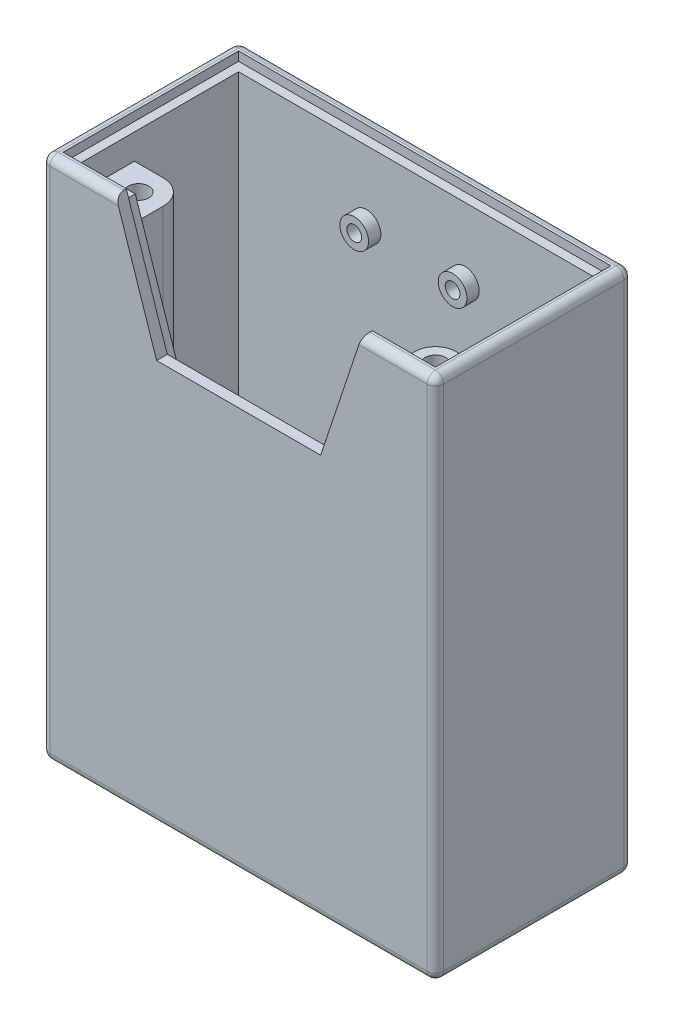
SolidWorks part; units mm, degrees
ref_plane "Ebene vorne" through (0, 0, 0) normal (0, 0, 1) x (1, 0, 0)
ref_plane "Ebene oben" through (0, 0, 0) normal (0, 1, 0) x (1, 0, 0)
ref_plane "Ebene rechts" through (0, 0, 0) normal (1, 0, 0) x (0, 0, -1)
sketch "Skizze1" plane through (0, 0, 0) normal (0, 1, 0) x (1, 0, 0)
  line L1 (24, 12) -> (-24, 12)
  line L2 (24, 12) -> (24, -12)
  line L3 (24, -12) -> (-24, -12)
  line L4 (-24, 12) -> (-24, -12)
  line L5 (24, 12) -> (-24, -12) construction
  line L6 (24, -12) -> (-24, 12) construction
  point P0 (0, 0)
  dimension "D1" = 24
  dimension "D2" = 48
extrude "Aufsatz-Linear austragen1" add sketch "Skizze1" along normal blind 8
sketch "Skizze2" plane through (0, 8, 0) normal (0, 1, 0) x (1, 0, 0)
  line L0 (-21.6, 9.6) -> (-21.6, -9.6)
  line L1 (-24, 12) -> (24, 12)
  line L2 (-24, 12) -> (-24, -12)
  line L3 (-24, -12) -> (24, -12)
  line L4 (24, 12) -> (24, -12)
  line L5 (-21.6, -9.6) -> (21.6, -9.6)
  line L6 (21.6, 9.6) -> (21.6, -9.6)
  line L7 (-21.6, 9.6) -> (21.6, 9.6)
  dimension "D1" = 2.4
extrude "Aufsatz-Linear austragen2" add sketch "Skizze2" along normal blind 56
sketch "Skizze6" plane through (0, 0, 12) normal (0, 0, 1) x (1, 0, 0)
  line L0 (0, 0) -> (0, 64) construction
  line L1 (-24, 0) -> (24, 0) construction
  line L2 (-24, 64) -> (24, 64) construction
  line L3 (15, 64) -> (-15, 64)
  line L4 (-15, 64) -> (-10, 49)
  line L5 (-10, 49) -> (10, 49)
  line L7 (15, 64) -> (10, 49)
  point P10 (0, 49)
  dimension "D1" = 10
  dimension "D2" = 15
  dimension "D3" = 15
extrude "Schnitt-Linear austragen3" cut sketch "Skizze6" against normal up to surface (2.4 mm away)
sketch "Skizze3" plane through (0, 0, 0) normal (0, -1, 0) x (1, 0, 0)
  line L0 (-24, 0) -> (0, 0) construction
  line L1 (-24, -12) -> (-24, 12) construction
  circle A0 centre (-4, 0) radius 4
  dimension "D1" = 8
  dimension "D2" = 20
extrude "Loch Achse" cut sketch "Skizze3" against normal up to surface (8 mm away)
sketch "Skizze4" plane through (0, 8, 0) normal (0, 1, 0) x (1, 0, 0)
  line L0 (-24, 0) -> (24, 0) construction
  line L1 (-24, 12) -> (-24, -12) construction
  line L2 (24, -12) -> (24, 12) construction
  line L3 (-21.6, -9.6) -> (-15, -9.6) construction
  line L4 (-21.6, 9.6) -> (-10.4, 9.6)
  line L5 (-21.6, 9.6) -> (-21.6, -9.6)
  line L6 (-21.6, -9.6) -> (-10.4, -9.6)
  line L7 (-10.4, 9.6) -> (-10.4, -9.6)
  line L8 (-21.6, -9.6) -> (21.6, -9.6) construction
  line L9 (21.6, 9.6) -> (12.9, 9.6)
  line L10 (21.6, 9.6) -> (21.6, -9.6)
  line L11 (21.6, -9.6) -> (12.9, -9.6)
  line L12 (12.9, 9.6) -> (12.9, -9.6)
  circle A0 centre (-12.4, 0) radius 0.8 construction
  circle A1 centre (15.2, 0) radius 0.8 construction
  dimension "D1" = 1.6
  dimension "D2" = 1.6
  dimension "D3" = 11.6
  dimension "D4" = 8.8
  dimension "D5" = 13.6
  dimension "D6" = 11.1
extrude "Aufsatz-Linear austragen3" add sketch "Skizze4" along normal blind 11.6
sketch "Skizze5" plane through (0, 19.6, 0) normal (0, 1, 0) x (1, 0, 0)
  line L0 (-24, 0) -> (24, 0) construction
  line L1 (-24, 12) -> (-24, -12) construction
  line L2 (24, -12) -> (24, 12) construction
  circle A0 centre (-12.4, 0) radius 0.8
  circle A1 centre (15.2, 0) radius 0.8
  dimension "D1" = 1.6
  dimension "D2" = 1.6
  dimension "D3" = 11.6
  dimension "D4" = 8.8
extrude "Schnitt-Linear austragen2" cut sketch "Skizze5" against normal blind 8
sketch "Skizze7" plane through (0, 64, 0) normal (0, 1, 0) x (1, 0, 0)
  line L0 (-15, -9.6) -> (-21.6, -9.6)
  line L1 (-21.6, -9.6) -> (-21.6, 9.6)
  line L2 (-21.6, 9.6) -> (21.6, 9.6)
  line L3 (21.6, 9.6) -> (21.6, -9.6)
  line L4 (21.6, -9.6) -> (15, -9.6)
  line L5 (-15, -10.7) -> (-22.7, -10.7)
  line L6 (-22.7, -10.7) -> (-22.7, 10.7)
  line L7 (-22.7, 10.7) -> (22.7, 10.7)
  line L8 (22.7, 10.7) -> (22.7, -10.7)
  line L9 (22.7, -10.7) -> (15, -10.7)
  line L10 (-15, -10.7) -> (-15, -9.6)
  line L11 (15, -9.6) -> (15, -10.7)
  dimension "D1" = 1.1
extrude "Schnitt-Linear austragen4" cut sketch "Skizze7" against normal blind 1.1 contours L6 L7 L8 L9 L11 L4 L3 L2 L1 L0 L10 L5
sketch "Skizze8" plane through (0, 0, 9.6) normal (0, 0, -1) x (-1, 0, 0)
  line L0 (-15, 64) -> (-10, 49)
  line L1 (-10, 49) -> (10, 49)
  line L2 (10, 49) -> (15, 64)
  line L3 (15, 64) -> (15, 62.9)
  line L4 (15, 62.9) -> (10, 47.9)
  line L5 (10, 47.9) -> (-10, 47.9)
  line L6 (-10, 47.9) -> (-15, 62.9)
  line L7 (-15, 64) -> (-15, 62.9)
  dimension "D1" = 1.1
extrude "Schnitt-Linear austragen5" cut sketch "Skizze8" against normal blind 1.1
sketch "Skizze9" plane through (0, 0, -9.6) normal (0, 0, 1) x (1, 0, 0)
  line L0 (0, 0) -> (0, 64) construction
  line L1 (-22.7, 64) -> (22.7, 64) construction
  circle A0 centre (-6, 54.4) radius 1.75
  circle A1 centre (6, 54.4) radius 1.75
  dimension "D1" = 6
  dimension "D2" = 3.5
  dimension "D3" = 9.6
extrude "Aufsatz-Linear austragen4" add sketch "Skizze9" along normal blind 1.5
sketch "Skizze10" plane through (0, 0, -8.1) normal (0, 0, 1) x (1, 0, 0)
  circle A0 centre (-6, 54.4) radius 0.9
  circle A1 centre (6, 54.4) radius 0.9
  dimension "D1" = 1.8
  dimension "D2" = 1.8
extrude "Schnitt-Linear austragen6" cut sketch "Skizze10" against normal blind 3
ref_plane "Ebene1" through (0, 59.8, 0) normal (0, 1, 0) x (1, 0, 0)
sketch "Skizze12" plane through (0, 59.8, 0) normal (0, 1, 0) x (1, 0, 0)
  line L0 (-18.1, -3.6) -> (-21.6, -3.6)
  line L1 (-21.6, -9.6) -> (-21.6, 9.6) construction
  line L2 (-21.6, -3.6) -> (-21.6, -9.6)
  line L3 (-21.6, -9.6) -> (-15.6, -9.6)
  line L4 (-15, -9.6) -> (-21.6, -9.6) construction
  line L5 (-15.6, -9.6) -> (-15.6, -6.1)
  line L6 (21.6, 9.6) -> (21.6, -9.6) construction
  line L7 (21.6, -9.6) -> (15, -9.6) construction
  line L8 (15.6, -6.1) -> (15.6, -9.6)
  line L9 (15.6, -9.6) -> (21.6, -9.6)
  line L10 (21.6, -9.6) -> (21.6, -3.6)
  line L11 (21.6, -3.6) -> (18.1, -3.6)
  circle A0 centre (-18.1, -6.1) radius 1.25
  circle A1 centre (18.1, -6.1) radius 1.25
  arc A3 (18.1, -3.6) -> (15.6, -6.1) centre (18.1, -6.1) ccw
  arc A4 (-15.6, -6.1) -> (-18.1, -3.6) centre (-18.1, -6.1) ccw
  dimension "D1" = 2.5
  dimension "D2" = 2.5
  dimension "D3" = 3.5
  dimension "D4" = 3.5
  dimension "D5" = 2.5
  dimension "D6" = 5
  dimension "D7" = 3.5
  dimension "D8" = 3.5
extrude "Montage_Deckel" add sketch "Skizze12" against normal blind 7
sketch "Skizze11" plane through (0, 19.6, 0) normal (0, 1, 0) x (1, 0, 0)
  line L0 (-21.6, -9.6) -> (-21.6, 9.6) construction
  line L1 (-15, -9.6) -> (-21.6, -9.6) construction
  line L2 (-18.1, -3.1) -> (-21.6, -3.1)
  line L3 (-15.1, -6.1) -> (-15.1, -9.6)
  line L4 (-10, -9.6) -> (-15, -9.6) construction
  line L5 (-15.1, -9.6) -> (-21.6, -9.6)
  line L6 (-21.6, -9.6) -> (-21.6, -3.1)
  circle A0 centre (-18.1, -6.1) radius 1.3
  arc A1 (-15.1, -6.1) -> (-18.1, -3.1) centre (-18.1, -6.1) ccw
  dimension "D1" = 3.5
  dimension "D3" = 2.6
  dimension "D4" = 3
  dimension "D2" = 3.5
extrude "Aufsatz-Linear austragen5" add sketch "Skizze11" along normal blind 40.2
sketch "Skizze14" plane through (0, 0, 0) normal (0, 0, 1) x (1, 0, 0)
  line L0 (0, 0) -> (-8, 0) construction
  line L1 (-4, 0) -> (-4, 6.3366) construction
  line L2 (-12, 11.0059) -> (-12, 0) construction
  line L3 (-8, 0) -> (-18.9294, 0) construction
  line L4 (-12, 0) -> (-8.95, 0)
  line L5 (-8.95, 0) -> (-8.95, 0.8)
  line L6 (-8.95, 0.8) -> (-9.45, 0.8)
  line L7 (-9.45, 0.8) -> (-9.45, 7)
  line L8 (-9.45, 7) -> (-8.95, 7)
  line L9 (-8.95, 7) -> (-8.95, 8)
  line L10 (-8.95, 8) -> (-12, 8)
  line L11 (-12, 8) -> (-12, 0)
  dimension "D1" = 8
  dimension "D2" = 3.05
  dimension "D3" = 2.55
  dimension "D4" = 3.05
  dimension "D5" = 0.8
  dimension "D6" = 6.2
  dimension "D7" = 1
revolve "Schnitt-Rotation1" cut sketch "Skizze14" angle 360 about L11
pattern_circular "Kreismuster1" count 4 every 90 about axis through (-4, 0, 0) along (0, 1, 0) of "Schnitt-Rotation1"
fillet "Verrundung1" radius 1 13 edges at (0, 0, -12) (-24, 32, -12) (-24, 0, 0) (-24, 32, 12) (0, 0, 12) (24, 0, 0) (24, 32, -12) (24, 32, 12) (19.5, 64, 12) (24, 64, 0) (0, 64, -12) (-24, 64, 0) (-19.5, 64, 12)
